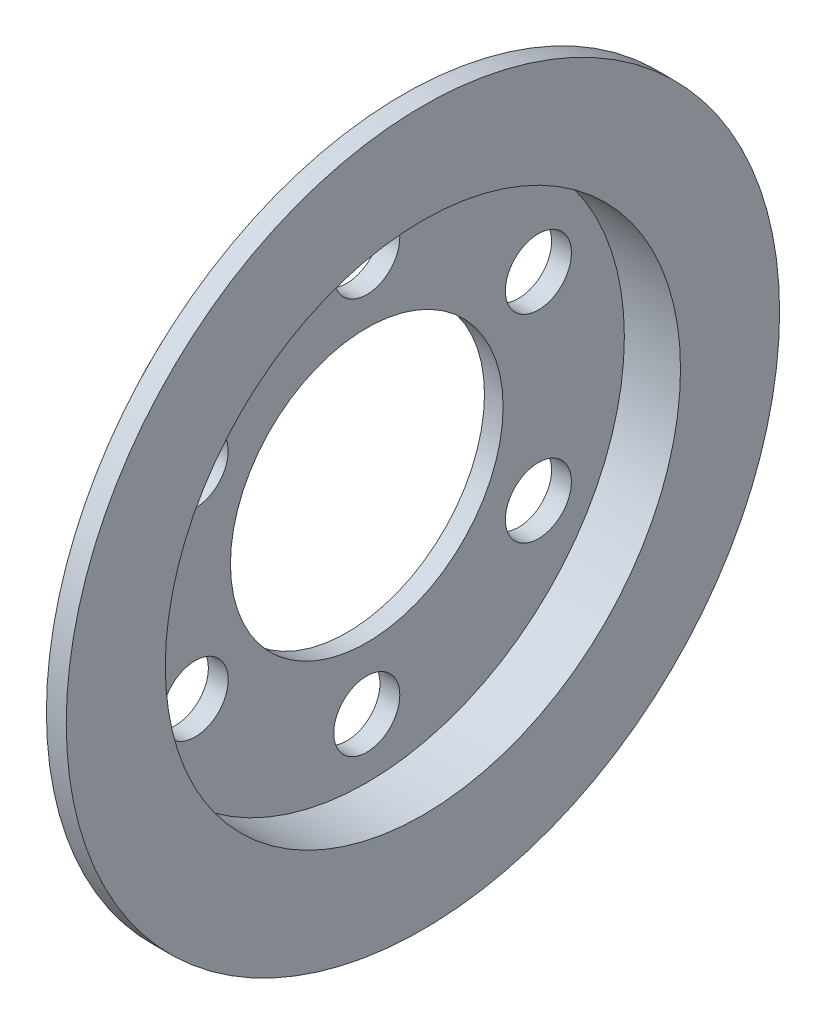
SolidWorks part; units mm, degrees
ref_plane "Front Plane" through (0, 0, 0) normal (0, 0, 1) x (1, 0, 0)
ref_plane "Top Plane" through (0, 0, 0) normal (0, 1, 0) x (1, 0, 0)
ref_plane "Right Plane" through (0, 0, 0) normal (1, 0, 0) x (0, 0, -1)
sketch "Sketch1" plane through (0, 0, 0) normal (0, 0, 1) x (1, 0, 0)
  line L0 (0, 0) -> (0, 61.3653) construction
  line L1 (8, 20.82) -> (8, 42)
  line L3 (8, 42) -> (16.5, 42)
  line L4 (16.5, 42) -> (16.5, 54)
  line L5 (16.5, 54) -> (19.5, 54)
  line L6 (19.5, 54) -> (19.5, 39)
  line L7 (19.5, 39) -> (11, 39)
  line L8 (11, 39) -> (11, 20.64)
  line L9 (11, 20.64) -> (8, 20.82)
  line L11 (-58.2728, 0) -> (69.955, 0) construction
  dimension "D2" = 3
  dimension "D3" = 3
  dimension "D4" = 3
  dimension "D5" = 108
  dimension "D6" = 84
  dimension "D7" = 33
revolve "Revolve1" add sketch "Sketch1" angle 360 about L11
sketch "Sketch2" plane through (11, 0, 0) normal (1, 0, 0) x (0, 0, -1)
  circle A0 centre (0, 0) radius 30 construction
  circle A1 centre (0, 30) radius 5
  circle A2 centre (25.9808, 15) radius 5
  circle A3 centre (25.9808, -15) radius 5
  circle A4 centre (0, -30) radius 5
  circle A5 centre (-25.9808, -15) radius 5
  circle A6 centre (-25.9808, 15) radius 5
  dimension "D1" = 60
  dimension "D2" = 10
  dimension "D3" = 6
extrude "Cut-Extrude1" cut sketch "Sketch2" against normal through all
